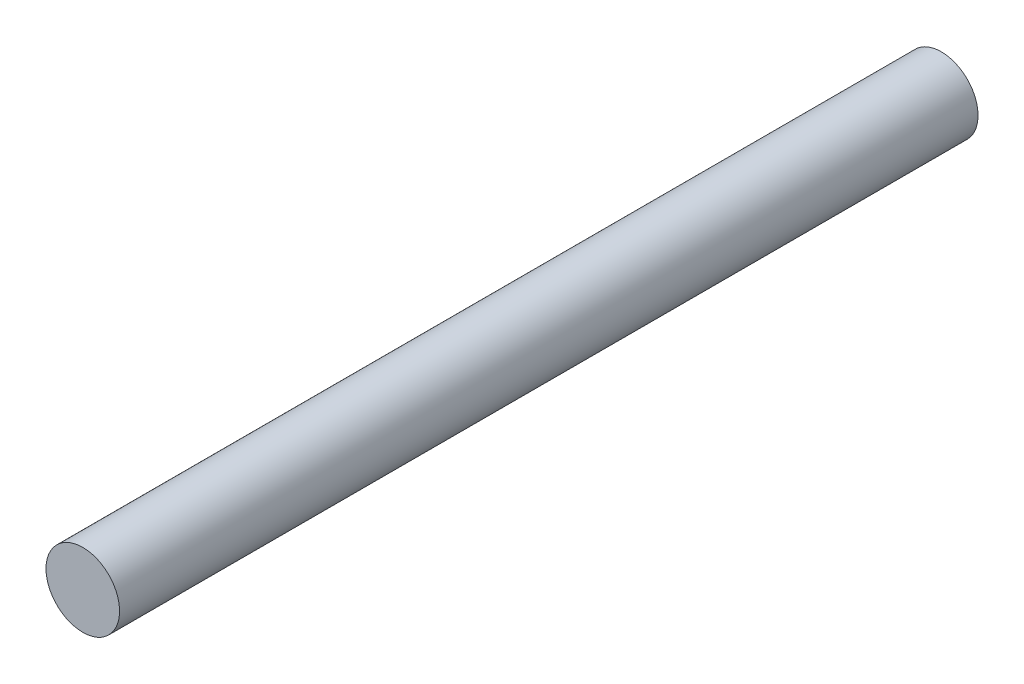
SolidWorks part; units mm, degrees
ref_plane "Front Plane" through (0, 0, 0) normal (0, 0, 1) x (1, 0, 0)
ref_plane "Top Plane" through (0, 0, 0) normal (0, 1, 0) x (1, 0, 0)
ref_plane "Right Plane" through (0, 0, 0) normal (1, 0, 0) x (0, 0, -1)
sketch "Sketch1" plane through (0, 0, 0) normal (0, 0, 1) x (1, 0, 0)
  circle A0 centre (0, 0) radius 1.5
  dimension "D1" = 3
extrude "Boss-Extrude1" add sketch "Sketch1" along normal mid plane 35
